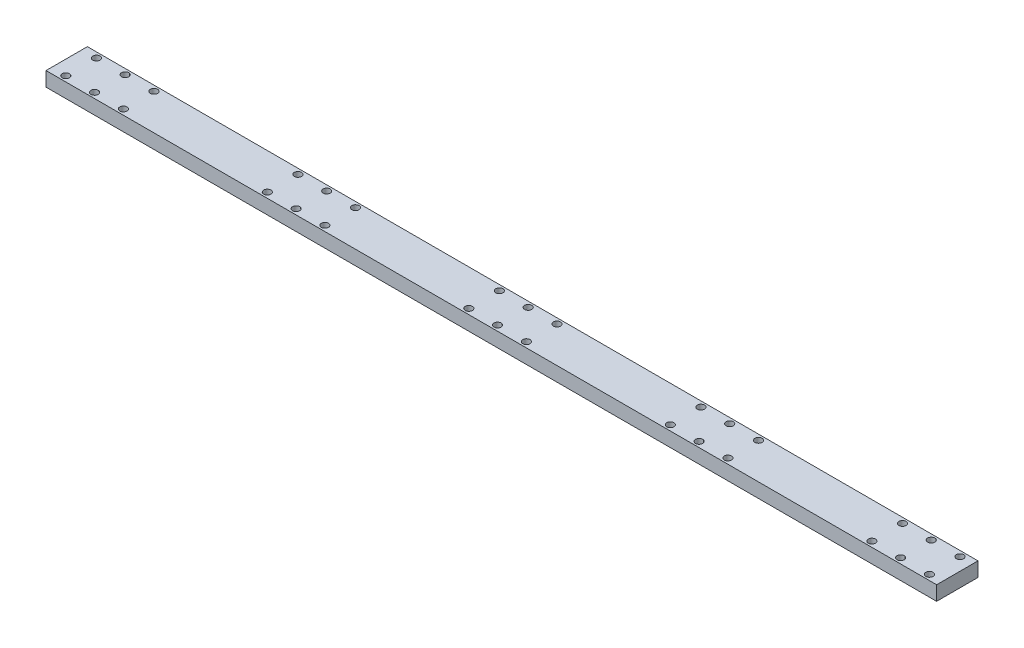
SolidWorks part; units mm, degrees
ref_plane "前视基准面" through (0, 0, 0) normal (0, 0, 1) x (1, 0, 0)
ref_plane "上视基准面" through (0, 0, 0) normal (0, 1, 0) x (1, 0, 0)
ref_plane "右视基准面" through (0, 0, 0) normal (1, 0, 0) x (0, 0, -1)
sketch "草图1" plane through (0, 0, 0) normal (0, 1, 0) x (1, 0, 0)
  line L1 (-20.2, 13.9) -> (474.8, 13.9)
  line L2 (-20.2, 13.9) -> (-20.2, -9.1)
  line L3 (-20.2, -9.1) -> (474.8, -9.1)
  line L4 (474.8, 13.9) -> (474.8, -9.1)
  circle A0 centre (-12.2, 10.9) radius 2
  circle A1 centre (3.8, 10.9) radius 2
  circle A2 centre (19.8, 10.9) radius 2
  circle A3 centre (-12.2, -6.1) radius 2
  circle A4 centre (3.8, -6.1) radius 2
  circle A5 centre (19.8, -6.1) radius 2
  circle A6 centre (99.8, 10.9) radius 2
  circle A7 centre (115.8, 10.9) radius 2
  circle A8 centre (131.8, 10.9) radius 2
  circle A9 centre (99.8, -6.1) radius 2
  circle A10 centre (115.8, -6.1) radius 2
  circle A11 centre (131.8, -6.1) radius 2
  circle A12 centre (211.8, 10.9) radius 2
  circle A13 centre (227.8, 10.9) radius 2
  circle A14 centre (243.8, 10.9) radius 2
  circle A15 centre (211.8, -6.1) radius 2
  circle A16 centre (227.8, -6.1) radius 2
  circle A17 centre (243.8, -6.1) radius 2
  circle A18 centre (323.8, 10.9) radius 2
  circle A19 centre (339.8, 10.9) radius 2
  circle A20 centre (355.8, 10.9) radius 2
  circle A21 centre (323.8, -6.1) radius 2
  circle A22 centre (339.8, -6.1) radius 2
  circle A23 centre (355.8, -6.1) radius 2
  circle A24 centre (435.8, 10.9) radius 2
  circle A25 centre (451.8, 10.9) radius 2
  circle A26 centre (467.8, 10.9) radius 2
  circle A27 centre (435.8, -6.1) radius 2
  circle A28 centre (451.8, -6.1) radius 2
  circle A29 centre (467.8, -6.1) radius 2
  dimension "D3" = 8
  dimension "D1" = 23
  dimension "D2" = 495
  dimension "D4" = 3
  dimension "D5" = 2
  dimension "D6" = 2
  dimension "D7" = 2
  dimension "D8" = 2
  dimension "D9" = 2
  dimension "D10" = 2
  dimension "D11" = 2
extrude "凸台-拉伸1" add sketch "草图1" along normal blind 8
